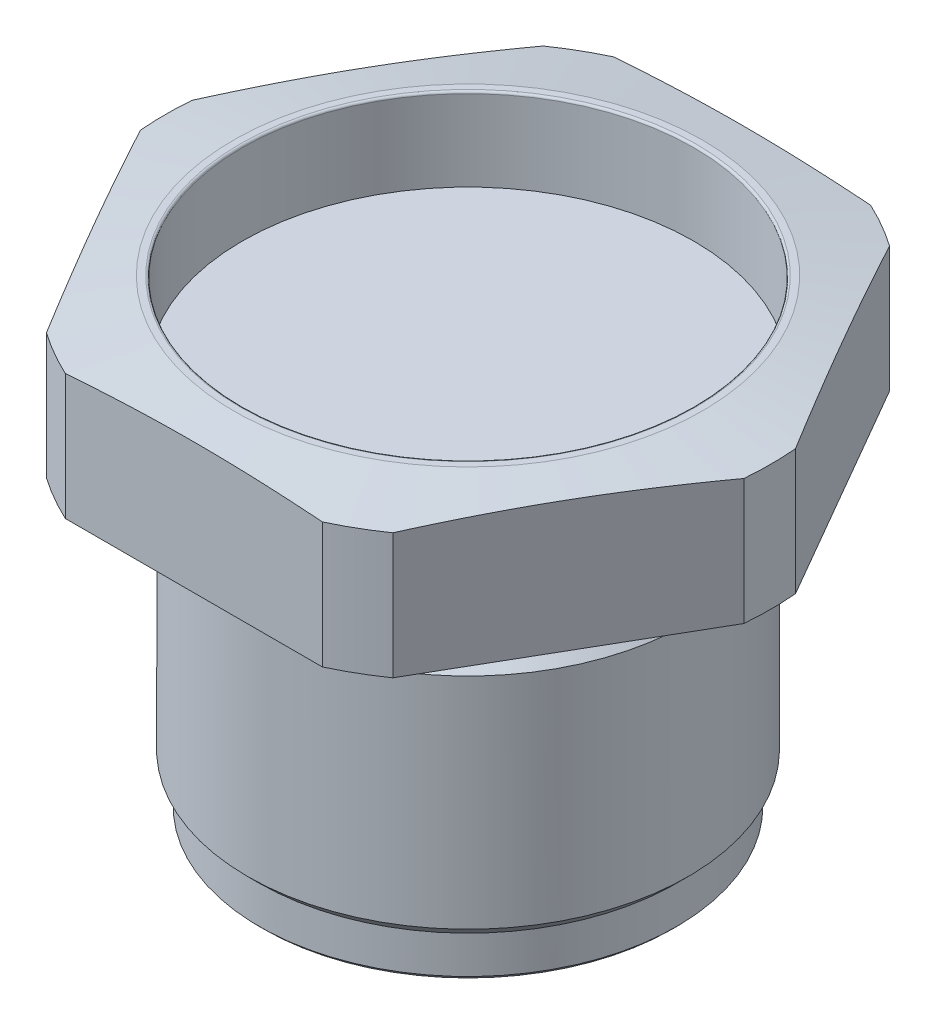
SolidWorks part; units mm, degrees
ref_plane "Front Plane" through (0, 0, 0) normal (0, 0, 1) x (1, 0, 0)
ref_plane "Top Plane" through (0, 0, 0) normal (0, 1, 0) x (1, 0, 0)
ref_plane "Right Plane" through (0, 0, 0) normal (1, 0, 0) x (0, 0, -1)
sketch "Sketch6" plane through (0, 0, 0) normal (0, 0, 1) x (1, 0, 0)
  line L0 (0, -8.9689) -> (0, 71.3762) construction
  line L1 (26.035, 15.875) -> (27.051, 15.875)
  line L2 (27.051, 15.875) -> (34.925, 14.4866)
  line L3 (34.925, 14.4866) -> (34.925, 0)
  line L4 (34.925, 0) -> (24.05, 0)
  line L5 (24.05, 0) -> (24.05, -37.6428)
  line L6 (24.05, -37.6428) -> (0, -37.6428)
  line L7 (0, -37.6428) -> (0, 6.2992)
  line L8 (26.035, 15.875) -> (26.035, 6.2992)
  line L9 (26.035, 6.2992) -> (0, 6.2992)
  dimension "D1" = 48.1
  dimension "D2" = 15.875
  dimension "D3" = 37.6428
  dimension "D4" = 69.85
  dimension "D5" = 10
  dimension "D6" = 54.102
  dimension "D7" = 9.5758
  dimension "D8" = 52.07
  dimension "D9" = 53.5178
revolve "Revolve3" add sketch "Sketch6" angle 360 about L0
fillet "Fillet7" radius 0.25 1 edges at (0, 15.875, -26.035)
sketch "Sketch7" plane through (0, 0, 0) normal (0, -1, 0) x (1, 0, 0)
  line L0 (0, 0) -> (0, -52.3237) construction
  line L1 (-18.2575, 31.623) -> (18.2575, 31.623)
  line L2 (18.2575, 31.623) -> (36.5151, 0)
  line L3 (36.5151, 0) -> (18.2575, -31.623)
  line L4 (18.2575, -31.623) -> (-18.2575, -31.623)
  line L5 (-18.2575, -31.623) -> (-36.5151, 0)
  line L6 (-36.5151, 0) -> (-18.2575, 31.623)
  circle A0 centre (0, 0) radius 36.5151 construction
  dimension "D1" = 63.246
extrude "Cut-Extrude5" cut sketch "Sketch7" against normal through all flip side to cut
chamfer "Chamfer2" distance 0.5 angle 45 1 edges at (0, -37.6428, -24.05)
sketch "Sketch8" plane through (0, 0, 0) normal (0, 0, 1) x (1, 0, 0)
  line L0 (-24.05, -4.826) -> (-24.05, -32.8168)
  line L1 (-24.05, 0) -> (-24.05, -37.1428) construction
  line L2 (-24.05, -32.8168) -> (-25.4, -31.4668)
  line L3 (-25.4, -31.4668) -> (-25.4, -6.176)
  line L4 (-25.4, -6.176) -> (-24.05, -4.826)
  line L5 (0, 0) -> (0, -37.1428) construction
  line L6 (-24.05, -37.1428) -> (24.05, -37.1428) construction
  line L7 (-23.55, -37.6428) -> (23.55, -37.6428) construction
  line L9 (-19.9745, 0) -> (-34.7982, 0) construction
  dimension "D1" = 45
  dimension "D2" = 50.8
  dimension "D3" = 4.826
  dimension "D4" = 4.826
revolve "Revolve4" add sketch "Sketch8" angle 360 about L5
fillet "Fillet8" radius 0.508 1 edges at (0, 0, -24.05)
sketch "Sketch9" plane through (0, 0, 0) normal (0, 0, 1) x (1, 0, 0)
  line L0 (0, 0) -> (0, -37.6428) construction
  line L1 (-23.55, -37.6428) -> (23.55, -37.6428) construction
  line L2 (0, -37.6428) -> (0, -36.2712)
  line L3 (0, -36.2712) -> (9.0043, -36.2712)
  line L4 (9.0043, -36.2712) -> (9.0043, -37.6428)
  line L5 (9.0043, -37.6428) -> (0, -37.6428)
  line L6 (10.9728, -37.6428) -> (10.9728, -37.1602)
  line L7 (11.1152, -37.6428) -> (10.9728, -37.6428)
  line L8 (12.7508, -37.1602) -> (12.7508, -37.6428)
  line L9 (12.7508, -37.6428) -> (12.6084, -37.6428)
  line L10 (15.7226, -36.2712) -> (21.3868, -36.2712)
  line L12 (20.6402, -37.6428) -> (14.351, -37.6428)
  arc A0 (15.7226, -36.2712) -> (14.351, -37.6428) centre (15.7226, -37.6428) ccw
  arc A1 (21.3868, -36.2712) -> (20.6402, -37.6428) centre (21.3868, -37.1602) ccw
  arc A2 (10.9728, -37.1602) -> (11.1152, -37.6428) centre (11.8618, -37.1602) ccw
  arc A3 (12.6084, -37.6428) -> (12.7508, -37.1602) centre (11.8618, -37.1602) ccw
  point P14 (15.7226, -36.2712)
  dimension "D2" = 1.778
  dimension "D1" = 0.4826
  dimension "D3" = 42.7736
  dimension "D4" = 28.702
  dimension "D5" = 18.0086
  dimension "D6" = 23.7236
revolve "Cut-Revolve1" cut sketch "Sketch9" angle 360 about L0
sketch "Sketch10" plane through (0, 0, 0) normal (0, 0, 1) x (1, 0, 0)
  line L0 (-22.1564, -37.6053) -> (-20.6172, -37.6053)
  line L2 (-12.6314, -37.6053) -> (-11.0922, -37.6053)
  line L3 (0, 0) -> (0, -34.798) construction
  arc A0 (-20.6402, -37.6428) -> (-21.3868, -36.2712) centre (-21.3868, -37.1602) ccw construction
  arc A1 (-22.1564, -37.6053) -> (-20.6172, -37.6053) centre (-21.3868, -37.1602) ccw
  arc A2 (-12.7508, -37.1602) -> (-12.6084, -37.6428) centre (-11.8618, -37.1602) ccw construction
  arc A5 (-12.6314, -37.6053) -> (-11.0922, -37.6053) centre (-11.8618, -37.1602) ccw
revolve "Revolve6" add sketch "Sketch10" angle 360 about L3
